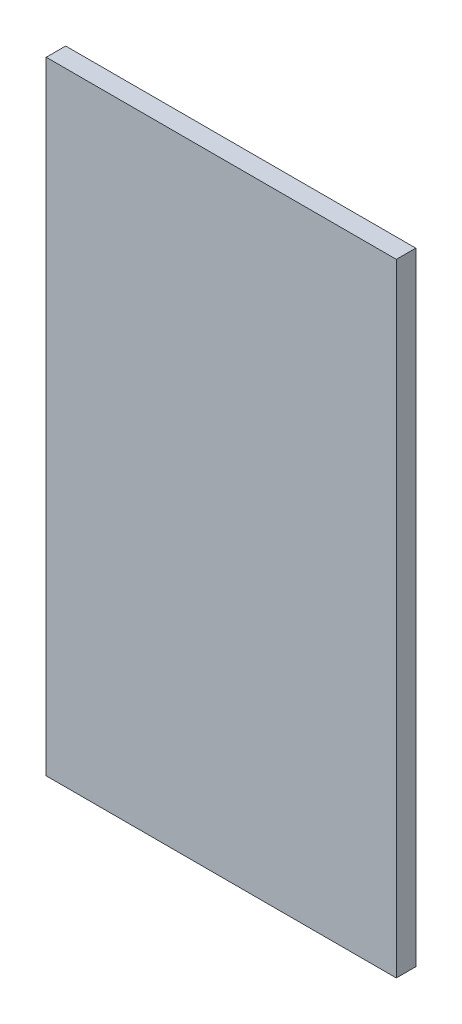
SolidWorks part; units mm, degrees
ref_plane "Front Plane" through (0, 0, 0) normal (0, 0, 1) x (1, 0, 0)
ref_plane "Top Plane" through (0, 0, 0) normal (0, 1, 0) x (1, 0, 0)
ref_plane "Right Plane" through (0, 0, 0) normal (1, 0, 0) x (0, 0, -1)
sketch "Sketch1" plane through (0, 0, 0) normal (0, 0, 1) x (1, 0, 0)
  line L1 (-90, 51.495) -> (0, 51.495)
  line L2 (-90, 51.495) -> (-90, -108.505)
  line L3 (-90, -108.505) -> (0, -108.505)
  line L4 (0, 51.495) -> (0, -108.505)
  line L5 (-90, 51.495) -> (0, -108.505) construction
  line L6 (-90, -108.505) -> (0, 51.495) construction
  point P0 (-45, -28.505)
  dimension "D1" = 90
  dimension "D2" = 160
extrude "Boss-Extrude1" add sketch "Sketch1" along normal blind 5
